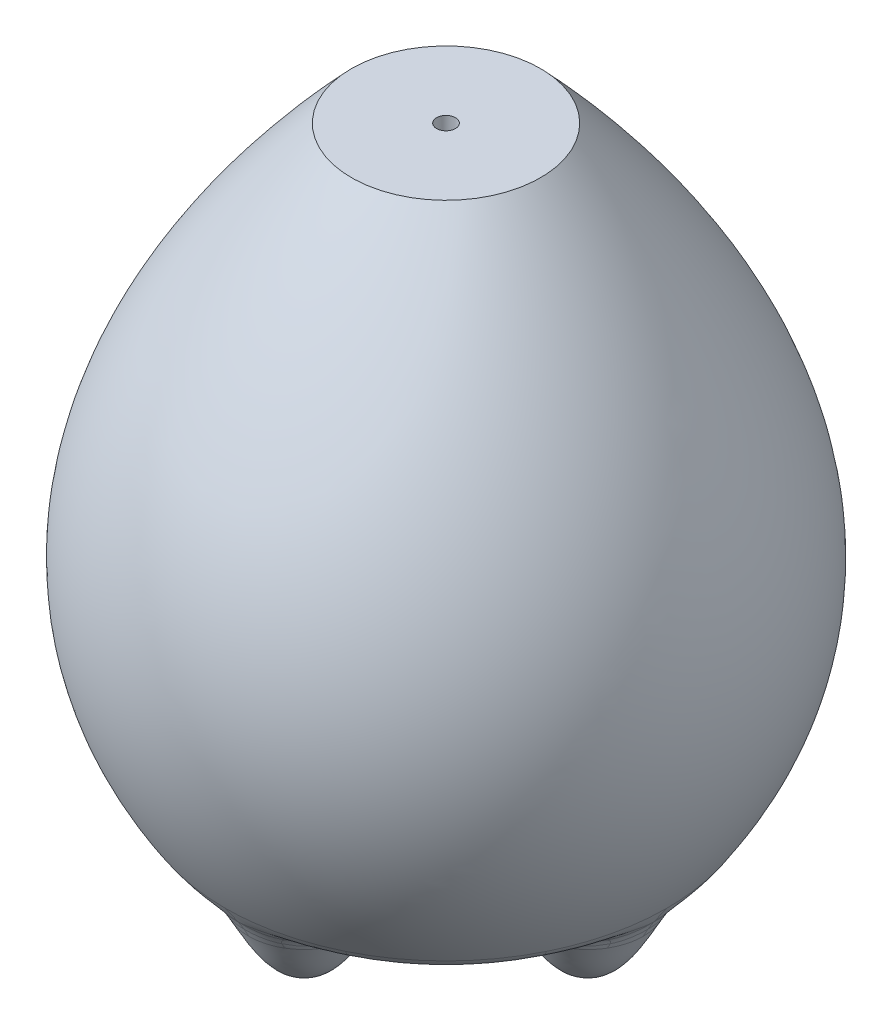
SolidWorks part; units mm, degrees
ref_plane "Alzado" through (0, 0, 0) normal (0, 0, 1) x (1, 0, 0)
ref_plane "Planta" through (0, 0, 0) normal (0, 1, 0) x (1, 0, 0)
ref_plane "Vista lateral" through (0, 0, 0) normal (1, 0, 0) x (0, 0, -1)
sketch "Croquis1" plane through (0, 0, 0) normal (0, 0, 1) x (1, 0, 0)
  line L0 (0, 106.4603) -> (0, -106.4603) construction
  line L1 (-50, 175) -> (50, 175) construction
  line L2 (-75, -175) -> (75, -175) construction
  line L3 (-140, -80) -> (140, -80) construction
  line L4 (-142.7957, -135) -> (142.7957, -135) construction
  line L5 (-50, 175) -> (0, 175)
  line L6 (0, 175) -> (0, -135)
  line L7 (0, -175) -> (-75, -175) construction
  line L8 (-140, -211.4552) -> (-140, 151.657) construction
  line L9 (-110.614, -135) -> (0, -135)
  spline S0 degree 3 poles (-110.614, -135) (-177.9418, -43.1441) (-157.7371, 60.1892) (-50, 175) knots 0.128835 0.128835 0.128835 0.128835 1 1 1 1
  point P4 (0, 0)
  point P8 (0, 175)
  point P11 (0, -175)
  point P14 (0, -80)
  point P17 (0, -135)
  dimension "D1" = 280
  dimension "D2" = 175
  dimension "D3" = 175
  dimension "D4" = 100
  dimension "D5" = 150
  dimension "D6" = 80
  dimension "D7" = 40
revolve "Revolución1" add sketch "Croquis1" angle 360 about L6
sketch "Croquis3" plane through (0, 0, 0) normal (0, 0, 1) x (1, 0, 0)
  line L0 (0, -175) -> (-75, -175) construction
  line L1 (-110.614, -135) -> (110.614, -135) construction
  line L2 (-75, -175) -> (-75, -113.46) construction
  line L3 (-110.614, -135) -> (-75, -132.6119)
  line L4 (-75, -132.6119) -> (-75, -175)
  spline S0 degree 3 poles (-75, -175) (-93.014, -175) (-100.067, -149.4037) (-110.614, -135) knots 0 0 0 0 1 1 1 1
  spline S1 degree 3 number of poles 882 (-50, 175) -> (-110.614, -135) construction
  spline S2 degree 3 poles (-75, -175) (-69.7881, -175) (-38.5239, -180.4652) (-54.331, -98.1384) (-13.2658, -106.6396) knots 0 0 0 0 0.124503 1 1 1 1 construction
  dimension "D1" = 175
  dimension "D2" = 75
revolve "Revolución2" add sketch "Croquis3" angle 360 about L2
pattern_circular "MatrizC2" count 4 over 360 about axis through (0, -135, 0) along (0, 1, 0) of "Revolución2"
fillet "Redondeo2" radius 20 7 edges at (78.2159, -135, 78.2159) (-35.614, -135, 75) (78.2159, -135, -78.2159) (75, -135, 35.614) (-78.2159, -135, -78.2159) (-78.2159, -135, 78.2159) (-75, -135, -35.614)
sketch "Croquis4" plane through (0, -135, 0) normal (0, -1, 0) x (1, 0, 0)
  circle A0 centre (0, 0) radius 30
  dimension "D1" = 60
extrude "Cortar-Extruir1" cut sketch "Croquis4" against normal blind 20
fillet "Redondeo3" radius 20 12 edges at (0, -135, -30) (28.2595, -135, 0) (21.2132, -135, 21.2132) (0, -135, 28.2595) (-21.2132, -135, 21.2132) (30, -135, 0) (0, -135, 30) (-30, -135, 0)
sketch "Croquis5" plane through (0, -115, 0) normal (0, -1, 0) x (1, 0, 0)
  circle A0 centre (0, 0) radius 5
  dimension "D1" = 10
extrude "Cortar-Extruir2" cut sketch "Croquis5" against normal through all
